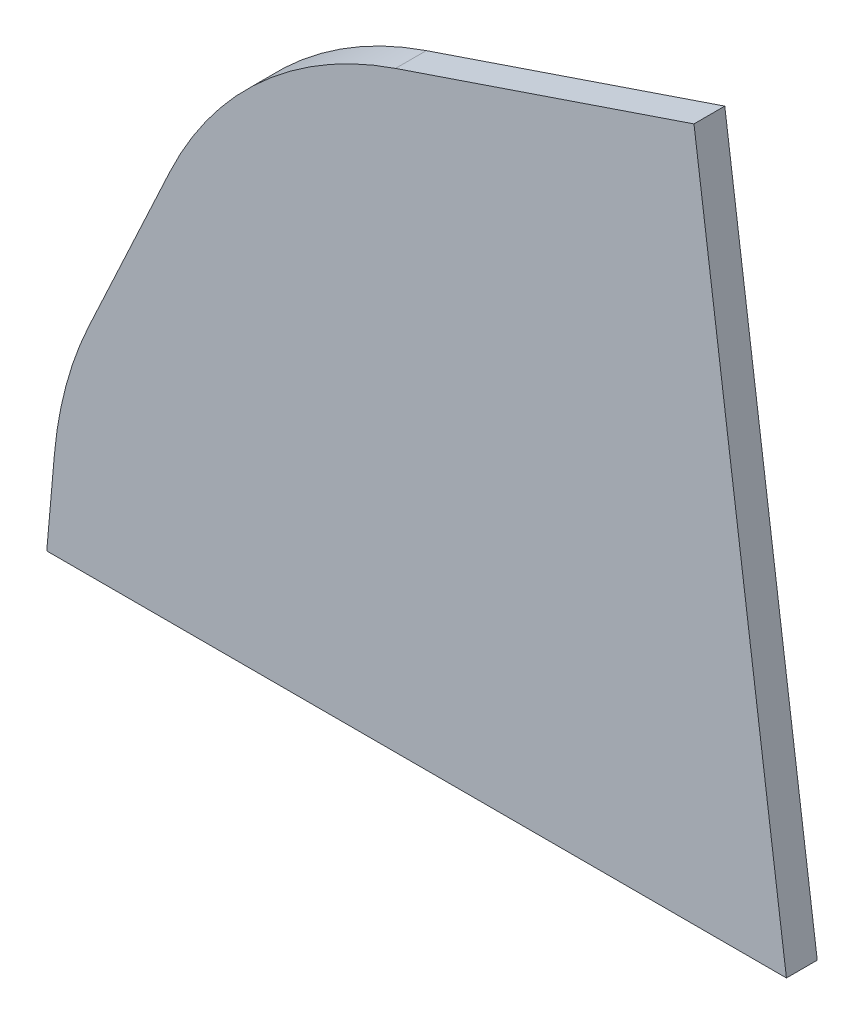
SolidWorks part; units mm, degrees
ref_plane "Přední" through (0, 0, 0) normal (0, 0, 1) x (1, 0, 0)
ref_plane "Horní" through (0, 0, 0) normal (0, 1, 0) x (1, 0, 0)
ref_plane "Pravá" through (0, 0, 0) normal (1, 0, 0) x (0, 0, -1)
sketch "Skica1" plane through (0, 0, 0) normal (0, 0, 1) x (1, 0, 0)
  line L0 (0, 0) -> (-12, 90)
  line L1 (-12, 90) -> (-71, 70)
  line L2 (-71, 70) -> (-94.2502, 20)
  line L3 (-94.2502, 20) -> (-96, 0)
  line L4 (-96, 0) -> (0, 0)
  dimension "D1" = 96
  dimension "D2" = 85
  dimension "D3" = 20
  dimension "D4" = 25
  dimension "D5" = 70
  dimension "D6" = 90
  dimension "D7" = 12
  dimension "D8" = 82.405
extrude "Vysunout1" add sketch "Skica1" along normal mid plane 4
fillet "Zaoblit1" radius 50 2 edges at (-71, 70, 0) (-94.2502, 20, 0)
